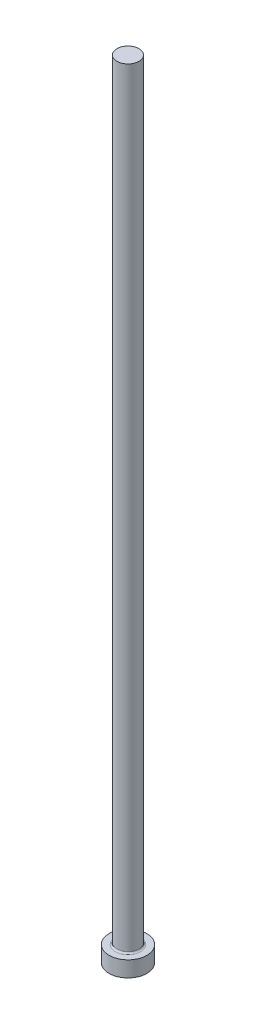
SolidWorks part; units mm, degrees
ref_plane "Plano frontal" through (0, 0, 0) normal (0, 0, 1) x (1, 0, 0)
ref_plane "Plano superior" through (0, 0, 0) normal (0, 1, 0) x (1, 0, 0)
ref_plane "Plano direito" through (0, 0, 0) normal (1, 0, 0) x (0, 0, -1)
sketch "Esboço1" plane through (0, 0, 0) normal (0, 0, 1) x (1, 0, 0)
  line L0 (0, 0) -> (6, 0)
  line L1 (6, 0) -> (6, 5)
  line L2 (6, 5) -> (4, 5)
  line L3 (3.5, 5.5) -> (3.5, 250)
  line L4 (3.5, 250) -> (0, 250)
  line L5 (0, 250) -> (0, 0) construction
  line L6 (0, 0) -> (0, 250)
  arc A0 (4, 5) -> (3.5, 5.5) centre (4, 5.5) cw
  dimension "D3" = 0.5
  dimension "D1" = 12
  dimension "D2" = 7
  dimension "D4" = 5
  dimension "D5" = 250
revolve "Revolução1" add sketch "Esboço1" angle 360 about L5
sketch "Esboço2"
  dimension "D1" = 1.05
  dimension "D2" = 0.675
  dimension "D3" = 3.225
  dimension "D4" = 0.45
wrap "Envolver1" sketch "Esboço2" wrap type deboss source sketch "Esboço2" thickness 0.1 parameters "D1"=0.1
